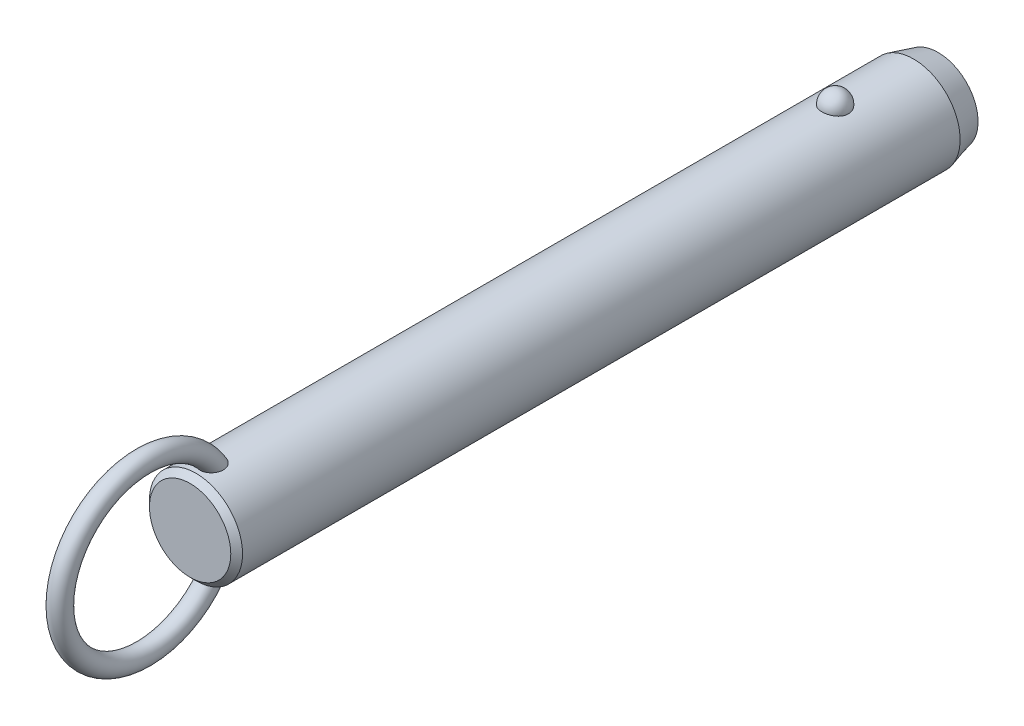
SolidWorks part; units mm, degrees
ref_plane "Front Plane" through (0, 0, 0) normal (0, 0, 1) x (1, 0, 0)
ref_plane "Top Plane" through (0, 0, 0) normal (0, 1, 0) x (1, 0, 0)
ref_plane "Right Plane" through (0, 0, 0) normal (1, 0, 0) x (0, 0, -1)
sketch "Sketch2" plane through (0, 0, 0) normal (0, 0, 1) x (1, 0, 0)
  circle A0 centre (0, 0) radius 9.5
  point P3 (0, 9.5)
  dimension "D1" = 19
extrude "Boss-Extrude1" add sketch "Sketch2" along normal blind 119.4
sketch "Sketch3" plane through (0, 0, 0) normal (0, 0, -1) x (-1, 0, 0)
  circle A0 centre (0, 0) radius 9.5
  dimension "D1" = 19
extrude "Boss-Extrude2" add sketch "Sketch3" along normal blind 23.7
chamfer "Chamfer1" distance 5 angle 15 1 edges at (-9.5, 0, -23.7)
sketch "Sketch12" plane through (0, 0, 0) normal (1, 0, 0) x (0, 0, -1)
  line L0 (-119.4, 9.5) -> (-119.4, -9.5) construction
  point P0 (-119.4, 0)
sketch "Sketch13" plane through (0, 0, 0) normal (1, 0, 0) x (0, 0, -1)
  circle A0 centre (-138.45, 0) radius 19.05
  point P2 (-119.4, 0)
  dimension "D1" = 38.1
sketch "Sketch14" plane through (0, 0, 0) normal (0, 1, 0) x (1, 0, 0)
  circle A0 centre (0, -121.4) radius 2
  point P2 (0, -119.4)
  dimension "D1" = 4
sweep "Sweep1" add profiles "Sketch14" path "Sketch13"
sketch "Sketch15" plane through (0, 0, 119.4) normal (0, 0, 1) x (1, 0, 0)
  circle A0 centre (0, 0) radius 9.5
  dimension "D1" = 19
extrude "Boss-Extrude3" add sketch "Sketch15" along normal blind 9.52
chamfer "Chamfer2" distance 1.2 angle 45 1 edges at (9.5, 0, 128.92)
sketch "Sketch18" plane through (0, 0, 0) normal (1, 0, 0) x (0, 0, -1)
  line L0 (18.7, 9.5) -> (-121.9378, 9.5) construction
  line L1 (2.7, 12.2) -> (2.7, 6.8)
  line L2 (-121.9378, -9.5) -> (18.7, -9.5) construction
  arc A0 (2.7, 12.2) -> (2.7, 6.8) centre (2.7, 9.5) ccw
  point P4 (0, 9.5)
  dimension "D1" = 21.7
revolve "Revolve1" add sketch "Sketch18" angle 360 about L1
